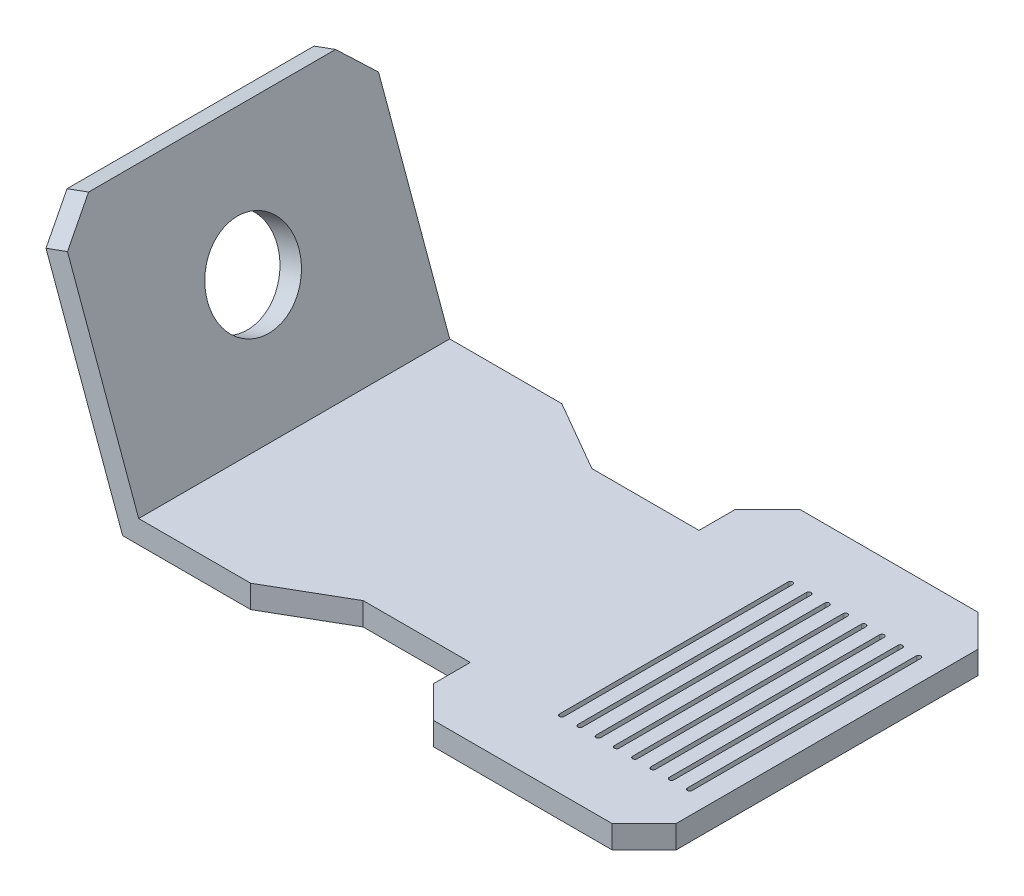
SolidWorks part; units mm, degrees
ref_plane "Front" through (0, 0, 0) normal (0, 0, 1) x (1, 0, 0)
ref_plane "Top" through (0, 0, 0) normal (0, 1, 0) x (1, 0, 0)
ref_plane "Right" through (0, 0, 0) normal (1, 0, 0) x (0, 0, -1)
sketch "Sketch2" plane through (0, 0, 0) normal (0, 1, 0) x (1, 0, 0)
  line L0 (0, 0) -> (-120, 0) construction
  line L1 (0, -40) -> (0, 40)
  line L2 (0, 40) -> (-53, 40)
  line L3 (0, -40) -> (-53, -40)
  line L4 (-53, 40) -> (-53, 25)
  line L5 (-53, -40) -> (-53, -25)
  line L6 (-53, 25) -> (-76.4115, 25)
  line L7 (-53, -25) -> (-76.4115, -25)
  line L8 (-76.4115, 25) -> (-92, 34)
  line L9 (-76.4115, -25) -> (-92, -34)
  line L10 (-92, 34) -> (-120, 34)
  line L11 (-92, -34) -> (-120, -34)
  line L12 (-120, 34) -> (-120, -34)
  dimension "D1" = 80
  dimension "D2" = 50
  dimension "D3" = 53
  dimension "D4" = 150
  dimension "D5" = 120
  dimension "D6" = 68
  dimension "D7" = 28
extrude "Boss-Extrude1" add sketch "Sketch2" along normal blind 5
sketch "Sketch3" plane through (0, 0, 0) normal (0, 0, 1) x (1, 0, 0)
  line L0 (-120, 0) -> (-139.1531, 52.6228)
  line L1 (-139.1531, 52.6228) -> (-134.4547, 54.3329)
  line L2 (-115.3015, 1.7101) -> (-134.4547, 54.3329)
  line L3 (-115.3015, 1.7101) -> (-120, 0)
  line L4 (-120, 5) -> (-92, 5) construction
  dimension "D2" = 110
  dimension "D3" = 56
extrude "Boss-Extrude2" add sketch "Sketch3" along normal up to surface and the other way up to surface
sketch "Sketch4" plane through (0, 5, 0) normal (0, 1, 0) x (1, 0, 0)
  line L0 (-5, -25) -> (-5, 25) construction
  line L1 (-5.5, -25) -> (-5.5, 25)
  line L2 (-4.5, -25) -> (-4.5, 25)
  line L5 (0, -40) -> (0, 40) construction
  line L6 (0, 40) -> (-53, 40) construction
  arc A0 (-5.5, -25) -> (-4.5, -25) centre (-5, -25) ccw
  arc A1 (-4.5, 25) -> (-5.5, 25) centre (-5, 25) ccw
  point P2 (-5, 0)
  dimension "D1" = 1
  dimension "D2" = 5
  dimension "D3" = 15
extrude "Cut-Extrude1" cut sketch "Sketch4" against normal through all
pattern_linear "LPattern1" count 8 spacing 4 along (-1, 0, 0) of "Cut-Extrude1"
sketch "Sketch5" plane through (-101.2642, -36.8572, 0) normal (0.9397, 0.342, 0) x (0, 0, -1)
  line L0 (0, 44.5435) -> (0, 97.0424) construction
  line L1 (34, 44.5435) -> (-34, 44.5435) construction
  line L2 (-34, 97.0424) -> (34, 97.0424) construction
  circle A0 centre (0, 70.7929) radius 10
  dimension "D1" = 20
extrude "Cut-Extrude2" cut sketch "Sketch5" against normal up to next
chamfer "Chamfer1" distance 7 angle 45 6 edges at (-136.8039, 53.4778, 34) (-136.8039, 53.4778, -34) (-53, 2.5, -40) (0, 2.5, -40) (-53, 2.5, 40) (0, 2.5, 40)
